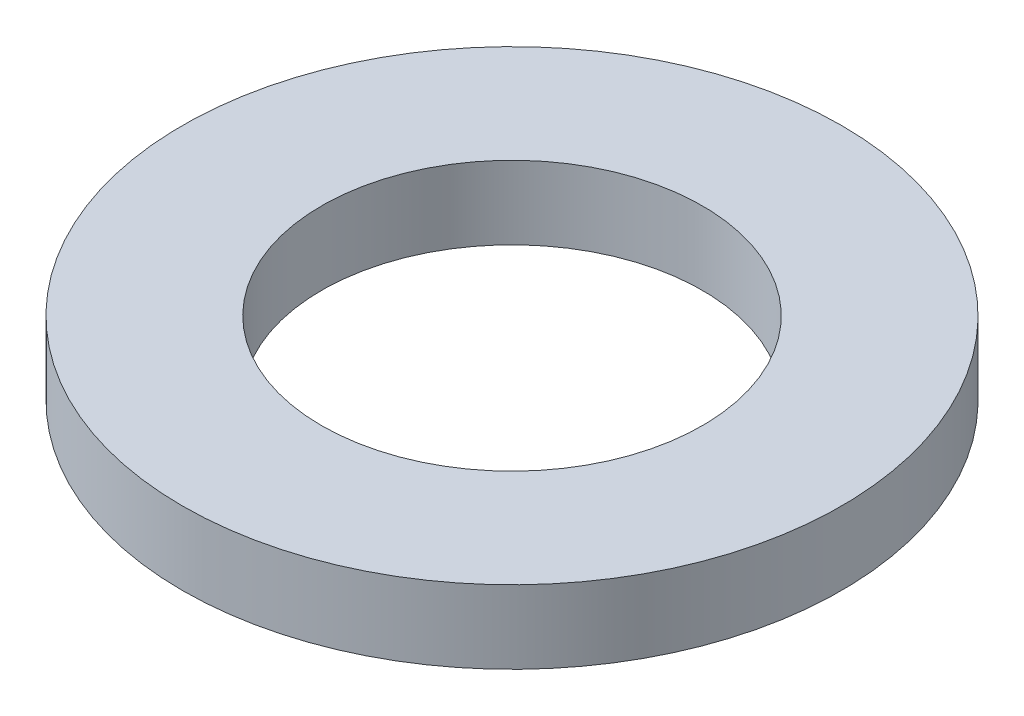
SolidWorks part; units mm, degrees
ref_plane "Plan de face" through (0, 0, 0) normal (0, 0, 1) x (1, 0, 0)
ref_plane "Plan de dessus" through (0, 0, 0) normal (0, 1, 0) x (1, 0, 0)
ref_plane "Plan de droite" through (0, 0, 0) normal (1, 0, 0) x (0, 0, -1)
sketch "Esquisse2" plane through (0, 0, 0) normal (0, 1, 0) x (1, 0, 0)
  circle A0 centre (0, 0) radius 22.5
  circle A1 centre (0, 0) radius 13
  dimension "D1" = 45
  dimension "D2" = 26
extrude "Extrusion1" add sketch "Esquisse2" along normal blind 5
